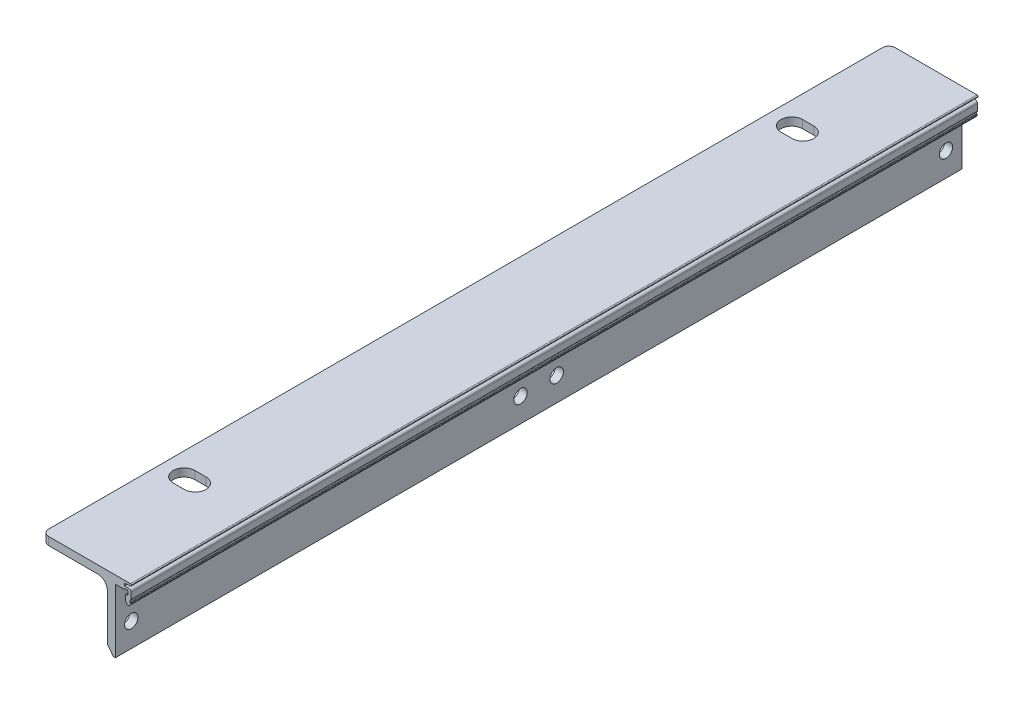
SolidWorks part; units mm, degrees
ref_plane "前视基准面" through (0, 0, 0) normal (0, 0, 1) x (1, 0, 0)
ref_plane "上视基准面" through (0, 0, 0) normal (0, 1, 0) x (1, 0, 0)
ref_plane "右视基准面" through (0, 0, 0) normal (1, 0, 0) x (0, 0, -1)
sketch "草图1" plane through (0, 0, 0) normal (0, 0, 1) x (1, 0, 0)
  line L0 (2329.984, -3290.1038) -> (2355.384, -3290.1038)
  line L1 (2329.984, -3292.6038) -> (2350.384, -3292.6038)
  line L2 (2352.884, -3292.6038) -> (2355.384, -3292.6038)
  line L3 (2350.384, -3292.6038) -> (2350.384, -3310.1038)
  line L4 (2352.884, -3292.6038) -> (2352.884, -3312.6038)
  line L5 (2355.384, -3292.6038) -> (2355.384, -3290.1038) construction
  line L6 (2355.384, -3290.1038) -> (2357.924, -3290.1038) construction
  line L8 (2329.984, -3290.1038) -> (2329.984, -3292.6038)
  line L10 (2352.884, -3312.6038) -> (2352.284, -3312.6038)
  line L11 (2350.384, -3310.1038) -> (2352.284, -3312.6038)
  line L12 (2356.524, -3292.3038) -> (2355.988, -3292.3038)
  line L13 (2357.5972, -3295.408) -> (2357.724, -3295.408)
  line L14 (2357.624, -3290.1038) -> (2357.924, -3290.1038) construction
  line L15 (2357.8006, -3295.5917) -> (2357.3831, -3296.0891)
  line L16 (2357.4972, -3294.808) -> (2357.4972, -3295.308)
  line L17 (2357.824, -3295.508) -> (2357.824, -3295.5274)
  line L18 (2357.824, -3292.376) -> (2357.824, -3294.2738)
  line L19 (2356.324, -3293.7038) -> (2356.524, -3293.7038)
  line L20 (2356.024, -3295.4545) -> (2356.024, -3294.0038)
  line L21 (2357.7449, -3290.6914) -> (2355.9031, -3290.8849)
  line L22 (2355.724, -3291.0839) -> (2355.724, -3291.4038)
  line L23 (2355.924, -3291.6038) -> (2356.77, -3291.6038)
  line L24 (2357.924, -3290.4038) -> (2357.924, -3290.4925)
  line L25 (2356.465, -3296.0891) -> (2356.0943, -3295.6474)
  line L26 (2356.824, -3293.4038) -> (2356.824, -3292.6038)
  line L27 (2357.924, -3290.4038) -> (2357.924, -3290.1038) construction
  line L28 (2355.384, -3292.6038) -> (2355.4683, -3292.6038)
  line L29 (2355.384, -3290.1038) -> (2357.624, -3290.1038)
  arc A0 (2357.4972, -3294.808) -> (2357.6606, -3294.5409) centre (2357.7972, -3294.808) cw
  arc A1 (2356.77, -3291.6038) -> (2357.7198, -3292.0704) centre (2356.77, -3292.8038) cw
  arc A2 (2357.824, -3295.5274) -> (2357.8006, -3295.5917) centre (2357.724, -3295.5274) cw
  arc A3 (2355.724, -3291.0839) -> (2355.9031, -3290.8849) centre (2355.924, -3291.0839) cw
  arc A4 (2357.924, -3290.4925) -> (2357.7449, -3290.6914) centre (2357.724, -3290.4925) cw
  arc A5 (2355.7282, -3292.4538) -> (2355.4683, -3292.6038) centre (2355.4683, -3292.3038) cw
  arc A6 (2357.624, -3290.1038) -> (2357.924, -3290.4038) centre (2357.624, -3290.4038) cw
  arc A7 (2357.5972, -3295.408) -> (2357.4972, -3295.308) centre (2357.5972, -3295.308) cw
  arc A8 (2357.824, -3294.2738) -> (2357.6606, -3294.5409) centre (2357.524, -3294.2738) cw
  arc A9 (2355.924, -3291.6038) -> (2355.724, -3291.4038) centre (2355.924, -3291.4038) cw
  arc A10 (2356.524, -3292.3038) -> (2356.824, -3292.6038) centre (2356.524, -3292.6038) cw
  arc A11 (2356.0943, -3295.6474) -> (2356.024, -3295.4545) centre (2356.324, -3295.4545) cw
  arc A12 (2355.7282, -3292.4538) -> (2355.988, -3292.3038) centre (2355.988, -3292.6038) cw
  arc A13 (2357.7198, -3292.0704) -> (2357.824, -3292.376) centre (2357.324, -3292.376) cw
  arc A14 (2356.024, -3294.0038) -> (2356.324, -3293.7038) centre (2356.324, -3294.0038) cw
  arc A15 (2356.824, -3293.4038) -> (2356.524, -3293.7038) centre (2356.524, -3293.4038) cw
  arc A16 (2357.3831, -3296.0891) -> (2356.465, -3296.0891) centre (2356.924, -3295.7038) cw
  arc A17 (2357.724, -3295.408) -> (2357.824, -3295.508) centre (2357.724, -3295.508) cw
  dimension "D1" = 20
  dimension "D2" = 0.6
  dimension "D3" = 2.5
  dimension "D4" = 20.4
  dimension "D5" = 127.235
extrude "凸台-拉伸1" add sketch "草图1" along normal mid plane 265.35
fillet "圆角2" radius 3 1 edges at (2350.384, -3292.6038, 0)
sketch "草图2" plane through (0, -3290.1038, 0) normal (0, 1, 0) x (1, 0, 0)
  line L0 (2338.734, 98.65) -> (2338.734, 91.85) construction
  line L3 (2370.3278, 0) -> (2329.984, 0) construction
  line L5 (2329.984, -132.675) -> (2329.984, 132.675) construction
  line L6 (2340.484, -91.85) -> (2336.984, -91.85)
  line L7 (2340.484, -98.65) -> (2336.984, -98.65)
  line L9 (2340.484, 98.65) -> (2336.984, 98.65)
  line L10 (2340.484, 91.85) -> (2336.984, 91.85)
  arc A0 (2336.984, -98.65) -> (2336.984, -91.85) centre (2336.984, -95.25) cw
  arc A1 (2336.984, 98.65) -> (2336.984, 91.85) centre (2336.984, 95.25) ccw
  arc A2 (2340.484, -91.85) -> (2340.484, -98.65) centre (2340.484, -95.25) cw
  arc A4 (2340.484, 91.85) -> (2340.484, 98.65) centre (2340.484, 95.25) ccw
  dimension "D4" = 8.75
  dimension "D1" = 190.5
  dimension "D5" = 3.5
  dimension "D6" = 3.4
extrude "切除-拉伸1" cut sketch "草图2" against normal through all
sketch "草图3" plane through (2350.384, 0, 0) normal (-1, 0, 0) x (0, 0, 1)
  line L0 (-132.675, -3295.6038) -> (-132.675, -3310.1038) construction
  line L1 (132.675, -3290.1038) -> (-132.675, -3290.1038) construction
  line L2 (0, -3290.1038) -> (0, -3328.2905) construction
  circle A0 centre (-127.675, -3305.1038) radius 2.1
  circle A1 centre (127.675, -3305.1038) radius 2.1
  circle A3 centre (-5.675, -3305.1038) radius 2.1
  circle A4 centre (5.675, -3305.1038) radius 2.1
  dimension "D1" = 4.2
  dimension "D2" = 5
  dimension "D3" = 15
  dimension "D5" = 2
  dimension "D8" = 122
  dimension "D9" = 11.35
extrude "切除-拉伸2" cut sketch "草图3" against normal through all
fillet "圆角1" radius 2 2 edges at (2329.984, -3291.3538, -132.675) (2329.984, -3291.3538, 132.675)
sketch "草图4" plane through (0, -3290.1038, 0) normal (0, 1, 0) x (1, 0, 0)
  line L0 (2329.984, 0) -> (2357.624, 0) construction
  line L1 (2329.984, -130.675) -> (2329.984, 130.675) construction
  line L3 (2357.624, -132.675) -> (2357.624, 132.675) construction
  circle A0 centre (2339.984, 124) radius 2.1
  circle A1 centre (2339.984, -124) radius 2.1
  dimension "D1" = 4.2
  dimension "D3" = 10
  dimension "D5" = 248
  dimension "D4" = 2
extrude "切除-拉伸5" [suppressed] cut sketch "草图4" against normal through all
chamfer "倒角1" [suppressed] distance 2 angle 45
